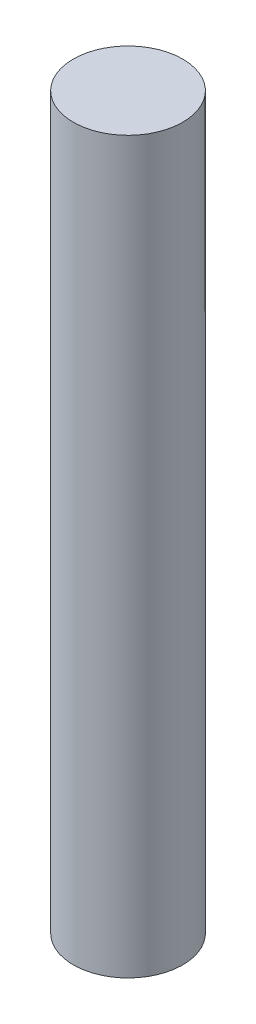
SolidWorks part; units mm, degrees
ref_plane "Alzado" through (0, 0, 0) normal (0, 0, 1) x (1, 0, 0)
ref_plane "Planta" through (0, 0, 0) normal (0, 1, 0) x (1, 0, 0)
ref_plane "Vista lateral" through (0, 0, 0) normal (1, 0, 0) x (0, 0, -1)
sketch "Croquis3" plane through (0, 0, 0) normal (0, 0, 1) x (1, 0, 0)
  line L0 (0, 0) -> (0, 20) construction
  line L1 (0, 20) -> (1.5, 20)
  line L2 (1.5, 20) -> (1.5, 0)
  line L3 (1.5, 0) -> (0, 0)
  line L4 (0, 0) -> (0, 20)
  dimension "D1" = 20
  dimension "D2" = 1.5
revolve "Revolución2" add sketch "Croquis3" angle 360 about L0
